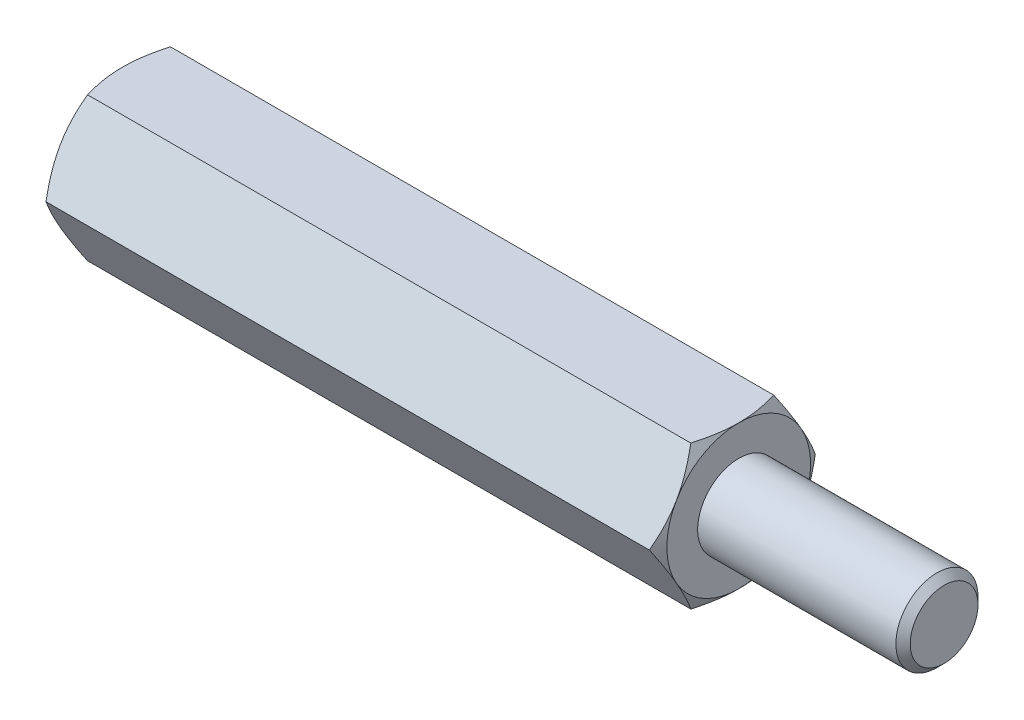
SolidWorks part; units mm, degrees
ref_plane "Front Plane" through (0, 0, 0) normal (0, 0, 1) x (1, 0, 0)
ref_plane "Top Plane" through (0, 0, 0) normal (0, 1, 0) x (1, 0, 0)
ref_plane "Right Plane" through (0, 0, 0) normal (1, 0, 0) x (0, 0, -1)
sketch "Sketch1" plane through (0, 0, 0) normal (1, 0, 0) x (0, 0, -1)
  line L1 (2.0207, 3.5) -> (-2.0207, 3.5)
  line L2 (-2.0207, 3.5) -> (-4.0415, 0)
  line L3 (-4.0415, 0) -> (-2.0207, -3.5)
  line L4 (-2.0207, -3.5) -> (2.0207, -3.5)
  line L5 (2.0207, -3.5) -> (4.0415, 0)
  line L6 (4.0415, 0) -> (2.0207, 3.5)
  circle A0 centre (0, 0) radius 3.5 construction
  dimension "D1" = 7
extrude "Extrude2" add sketch "Sketch1" along normal mid plane 30
sketch "Sketch2" plane through (0, 0, 0) normal (0, 0, 1) x (1, 0, 0)
  line L0 (-15, 3.5) -> (-13.5, 6.0981)
  line L1 (-15, 6.5) -> (-15, 3.5)
  line L3 (0, 0) -> (50000, 0) construction
  arc A0 (-13.5, 6.0981) -> (-15, 6.5) centre (-14.1962, 6.5) ccw
  dimension "D1" = 30
  dimension "D2" = 3
revolve "Cut-Revolve1" cut sketch "Sketch2" angle 360 about L3
mirror "Mirror1" about plane through (0, 0, 0) normal (1, 0, 0) of "Cut-Revolve1"
sketch "Sketch3" plane through (-15, 0, 0) normal (-1, 0, 0) x (0, 0, 1)
  circle A0 centre (0, 0) radius 1.65
  dimension "D1" = 3.3
extrude "Extrude3" cut sketch "Sketch3" against normal blind 10
sketch "Sketch4" plane through (0, 0, 0) normal (0, 0, 1) x (1, 0, 0)
  line L0 (-5, 0) -> (-5, 1.65)
  line L1 (14.6874, 0) -> (-14.6874, 0) construction
  line L2 (-5, 1.65) -> (-4.0474, 0)
  line L3 (-4.0474, 0) -> (-5, 0)
  line L4 (-15, 1.75) -> (-15, -1.75) construction
  point P4 (-15, 0)
  dimension "D1" = 30
  dimension "D2" = 1.65
  dimension "D3" = 10
revolve "Cut-Revolve2" cut sketch "Sketch4" angle 360 about L3
sketch "Sketch5" plane through (15, 0, 0) normal (1, 0, 0) x (0, 0, -1)
  circle A0 centre (0, 0) radius 2
  dimension "D1" = 4
extrude "Extrude4" add sketch "Sketch5" along normal blind 10
chamfer "Chamfer1" distance 0.35 angle 45 1 edges at (25, 0, -2)
equation "\"D2@Sketch4\" = \"D1@Sketch3\"/2"
